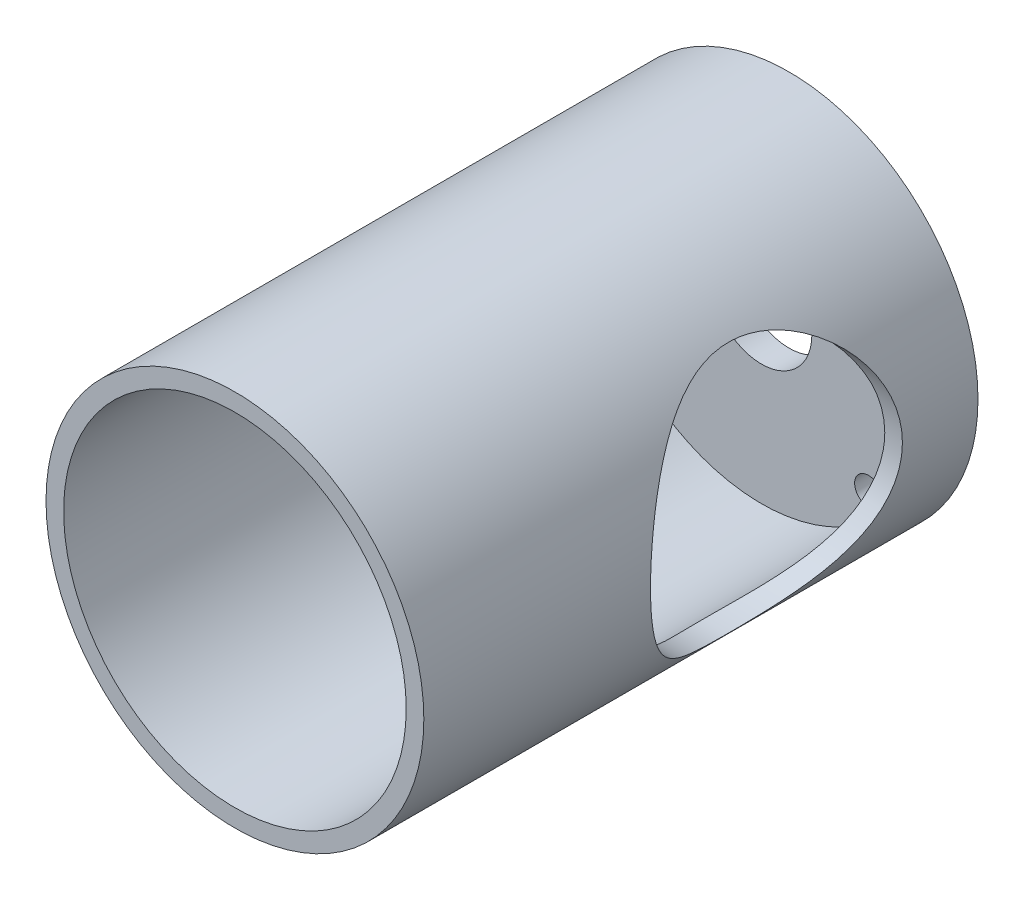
SolidWorks part; units mm, degrees
ref_plane "Front Plane" through (0, 0, 0) normal (0, 0, 1) x (1, 0, 0)
ref_plane "Top Plane" through (0, 0, 0) normal (0, 1, 0) x (1, 0, 0)
ref_plane "Right Plane" through (0, 0, 0) normal (1, 0, 0) x (0, 0, -1)
sketch "Sketch1" plane through (0, 0, 0) normal (1, 0, 0) x (0, 0, -1)
  line L0 (-8.8247, 0) -> (15.3587, 0) construction
  line L1 (-0.3048, 6.35) -> (-0.3048, 9.05)
  line L2 (-0.3048, 9.05) -> (0, 9.05)
  line L3 (0, 9.05) -> (0, 23.8125)
  line L4 (0, 23.8125) -> (-69.85, 23.8125)
  line L5 (-69.85, 23.8125) -> (-69.85, 21.59)
  line L6 (-69.85, 21.59) -> (-3.4798, 21.59)
  line L7 (-3.4798, 21.59) -> (-3.4798, 6.35)
  line L8 (-3.4798, 6.35) -> (-0.3048, 6.35)
  line L9 (-0.3048, 6.35) -> (0, 6.35)
  line L10 (0, 6.35) -> (0, 9.05)
  dimension "D1" = 18.1
  dimension "D2" = 12.7
  dimension "D3" = 47.625
  dimension "D4" = 43.18
  dimension "D5" = 0.3048
  dimension "D6" = 3.175
  dimension "D7" = 69.85
revolve "Revolve1" add sketch "Sketch1" angle 360 about L0
sketch "Sketch2" plane through (0, 0, 0) normal (0, 0, -1) x (-1, 0, 0)
  line L0 (13.4704, 13.4704) -> (0, 0) construction
  line L1 (0, 23.8125) -> (0, 0) construction
  circle A0 centre (13.4704, 13.4704) radius 1.7272
  circle A1 centre (0, 0) radius 23.8125 construction
  dimension "D2" = 3.4544
  dimension "D1" = 19.05
  dimension "D3" = 45
extrude "Cut-Extrude1" cut sketch "Sketch2" against normal blind 12.7
pattern_circular "CirPattern1" count 4 over 360 about axis through (0, 0, 0) along (0, 0, 1) of "Cut-Extrude1"
sketch "Sketch3" plane through (0, 0, 0) normal (1, 0, 0) x (0, 0, -1)
  line L0 (0, -23.8125) -> (0, 23.8125) construction
  circle A0 centre (-25.4, 0) radius 15.875
  dimension "D1" = 31.75
  dimension "D2" = 25.4
extrude "Cut-Extrude2" cut sketch "Sketch3" against normal through all both and the other way through all
